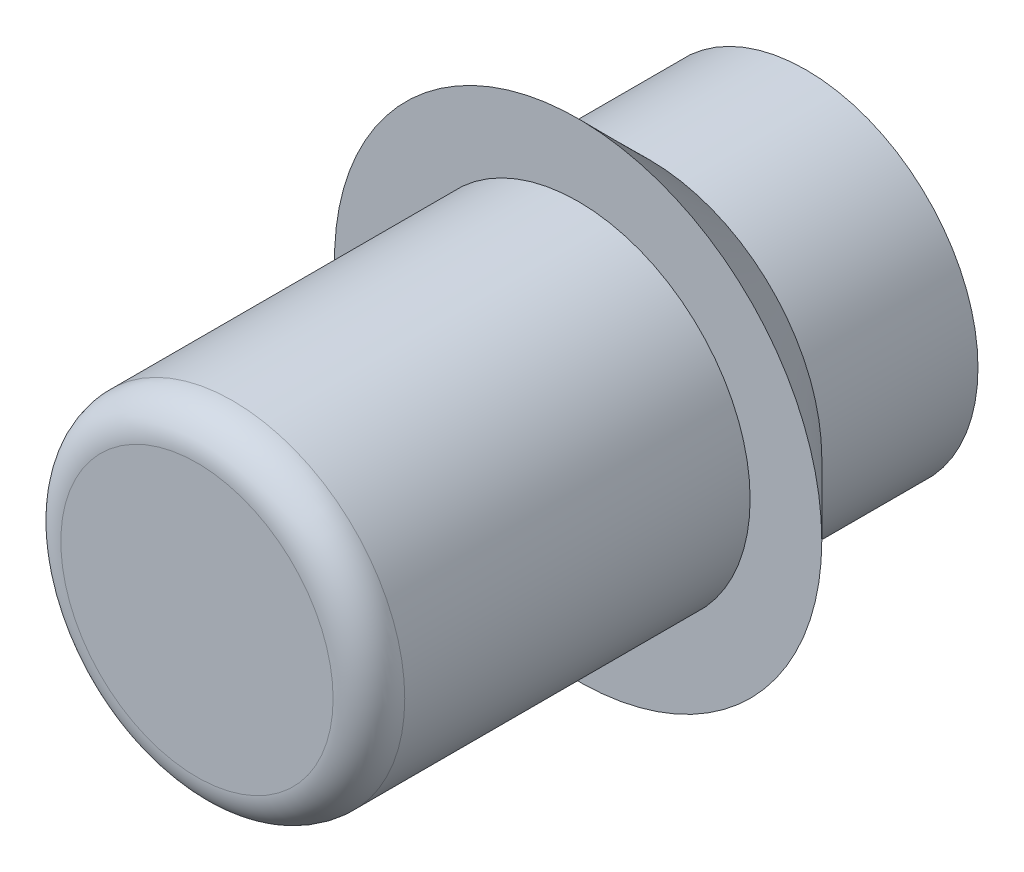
SolidWorks part; units mm, degrees
ref_plane "Спереди" through (0, 0, 0) normal (0, 0, 1) x (1, 0, 0)
ref_plane "Сверху" through (0, 0, 0) normal (0, 1, 0) x (1, 0, 0)
ref_plane "Справа" through (0, 0, 0) normal (1, 0, 0) x (0, 0, -1)
sketch "Эскиз1" plane through (0, 0, 0) normal (0, 0, 1) x (1, 0, 0)
  circle A0 centre (0, 0) radius 2.4
  dimension "D1" = 4.8
extrude "Бобышка-Вытянуть1" add sketch "Эскиз1" along normal blind 8.5
ref_plane "Плоскость1" through (0, 0, 3.18) normal (0, 0, 1) x (1, 0, 0)
sketch "Эскиз2" plane through (0, 0, 3.18) normal (0, 0, 1) x (1, 0, 0)
  circle A0 centre (0, 0) radius 3.4
  dimension "D1" = 6.8
extrude "Бобышка-Вытянуть2" add sketch "Эскиз2" against normal blind 2
chamfer "Фаска1" distance 2 angle 45 1 edges at (3.4, 0, 1.18)
fillet "Скругление1" radius 0.5 1 edges at (2.4, 0, 8.5)
